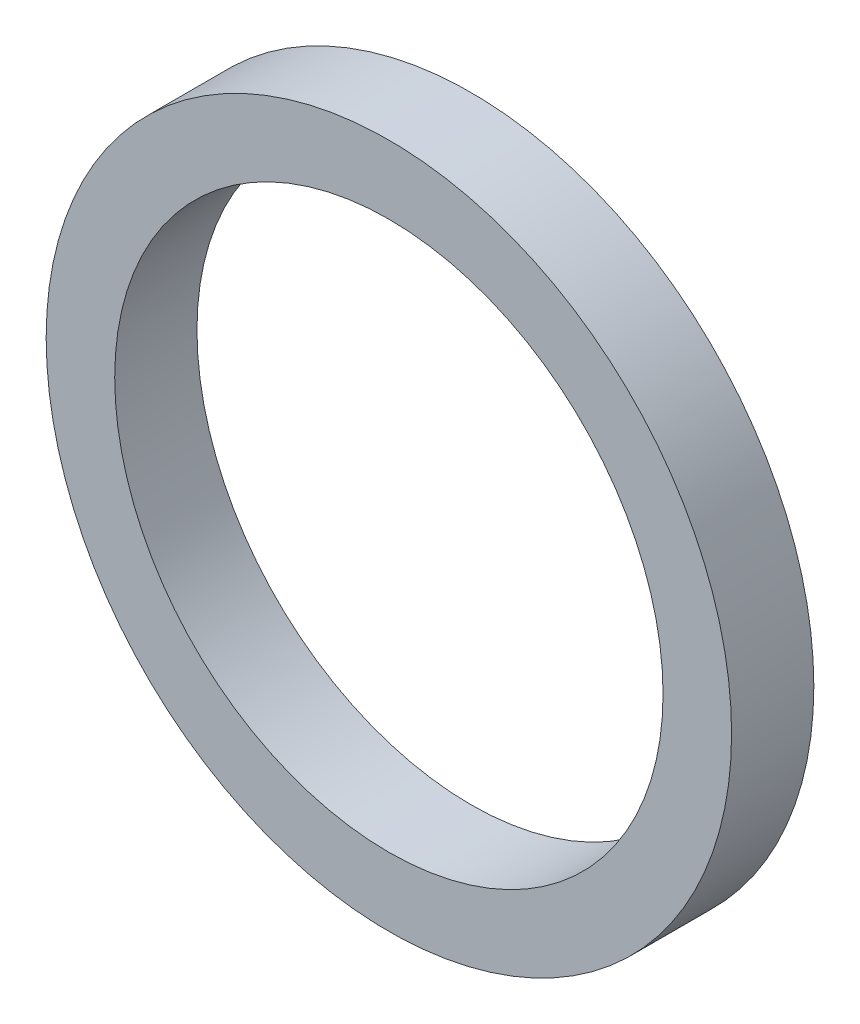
SolidWorks part; units mm, degrees
ref_plane "前视基准面" through (0, 0, 0) normal (0, 0, 1) x (1, 0, 0)
ref_plane "上视基准面" through (0, 0, 0) normal (0, 1, 0) x (1, 0, 0)
ref_plane "右视基准面" through (0, 0, 0) normal (1, 0, 0) x (0, 0, -1)
sketch "草图1" plane through (0, 0, 0) normal (0, 0, 1) x (1, 0, 0)
  circle A0 centre (0, 0) radius 12.5
  circle A1 centre (0, 0) radius 10
  dimension "D1" = 20
  dimension "D2" = 25
extrude "拉伸1" add sketch "草图1" along normal blind 3
